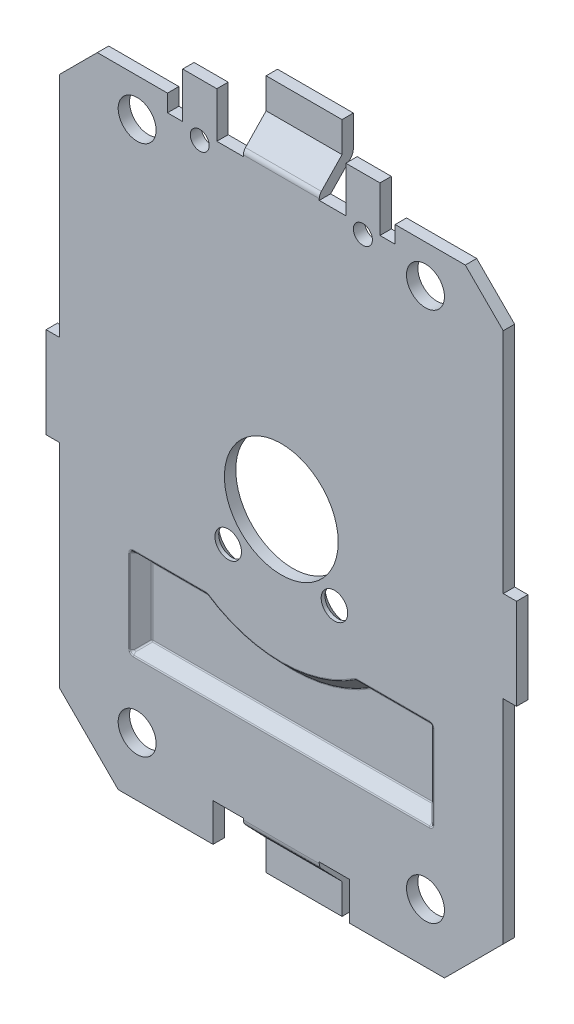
SolidWorks part; units mm, degrees
ref_plane "Plan de face" through (0, 0, 0) normal (0, 0, 1) x (1, 0, 0)
ref_plane "Plan de dessus" through (0, 0, 0) normal (0, 1, 0) x (1, 0, 0)
ref_plane "Plan de droite" through (0, 0, 0) normal (1, 0, 0) x (0, 0, -1)
sketch "Esquisse1" plane through (0, 0, 0) normal (0, 0, 1) x (1, 0, 0)
  line L8 (-31, 37.5) -> (-31, 7)
  line L9 (-31, 7) -> (-29.2494, 7)
  line L10 (-29.2494, 7) -> (-29.2494, 37.5)
  line L11 (-23, 43.7494) -> (23, 43.7494)
  line L12 (29.2494, 37.5) -> (29.2494, 7)
  line L13 (29.2494, 7) -> (31, 7)
  line L14 (31, 7) -> (31, 37.5)
  line L15 (23, 45.5) -> (-23, 45.5)
  line L16 (-31, 37.5) -> (-31, 7)
  line L17 (-31, 7) -> (-29.2494, 7)
  line L18 (-29.2494, 7) -> (-29.2494, 37.5)
  line L19 (-23, 43.7494) -> (23, 43.7494)
  line L20 (29.2494, 37.5) -> (29.2494, 7)
  line L21 (29.2494, 7) -> (31, 7)
  line L22 (31, 7) -> (31, 37.5)
  line L23 (23, 45.5) -> (-23, 45.5)
  line L24 (31, -37.5) -> (31, -7)
  line L25 (31, -7) -> (29.2494, -7)
  line L26 (29.2494, -7) -> (29.2494, -37.5)
  line L27 (23, -43.7494) -> (-23, -43.7494)
  line L28 (-29.2494, -37.5) -> (-29.2494, -7)
  line L29 (-29.2494, -7) -> (-31, -7)
  line L30 (-31, -7) -> (-31, -37.5)
  line L31 (-23, -45.5) -> (23, -45.5)
  line L32 (31, -37.5) -> (31, -7)
  line L33 (31, -7) -> (29.2494, -7)
  line L34 (29.2494, -7) -> (29.2494, -37.5)
  line L35 (23, -43.7494) -> (-23, -43.7494)
  line L36 (-29.2494, -37.5) -> (-29.2494, -7)
  line L37 (-29.2494, -7) -> (-31, -7)
  line L38 (-31, -7) -> (-31, -37.5)
  line L39 (-23, -45.5) -> (23, -45.5)
  arc A0 (-2.9394, 6.9) -> (2.9394, 6.9) centre (0, 0) ccw construction
  arc A1 (2.9394, 6.9) -> (-2.9394, 6.9) centre (0, 7.5) ccw construction
  circle A2 centre (-7, -7.5) radius 1.75 construction
  circle A3 centre (7, -7.5) radius 1.75 construction
  arc A4 (-23, 43.7494) -> (-29.2494, 37.5) centre (-23, 37.5) ccw
  arc A5 (29.2494, 37.5) -> (23, 43.7494) centre (23, 37.5) ccw
  arc A6 (31, 37.5) -> (23, 45.5) centre (23, 37.5) ccw
  arc A7 (-23, 45.5) -> (-31, 37.5) centre (-23, 37.5) ccw
  arc A8 (-23, 43.7494) -> (-29.2494, 37.5) centre (-23, 37.5) ccw
  arc A9 (29.2494, 37.5) -> (23, 43.7494) centre (23, 37.5) ccw
  arc A10 (31, 37.5) -> (23, 45.5) centre (23, 37.5) ccw
  arc A11 (-23, 45.5) -> (-31, 37.5) centre (-23, 37.5) ccw
  arc A12 (23, -43.7494) -> (29.2494, -37.5) centre (23, -37.5) ccw
  arc A13 (-29.2494, -37.5) -> (-23, -43.7494) centre (-23, -37.5) ccw
  arc A14 (-31, -37.5) -> (-23, -45.5) centre (-23, -37.5) ccw
  arc A15 (23, -45.5) -> (31, -37.5) centre (23, -37.5) ccw
  arc A16 (23, -43.7494) -> (29.2494, -37.5) centre (23, -37.5) ccw
  arc A17 (-29.2494, -37.5) -> (-23, -43.7494) centre (-23, -37.5) ccw
  arc A18 (-31, -37.5) -> (-23, -45.5) centre (-23, -37.5) ccw
  arc A19 (23, -45.5) -> (31, -37.5) centre (23, -37.5) ccw
  circle A20 centre (-19, -35) radius 2.5 construction
  circle A21 centre (19, -35) radius 2.5 construction
  circle A22 centre (19, 35) radius 2.5 construction
  circle A23 centre (-19, 35) radius 2.5 construction
  arc A24 (-2.9394, 6.9) -> (2.9394, 6.9) centre (0, 0) ccw
  arc A25 (2.9394, 6.9) -> (-2.9394, 6.9) centre (0, 7.5) ccw
  circle A26 centre (-7, -7.5) radius 1.75
  circle A27 centre (7, -7.5) radius 1.75
  circle A28 centre (-19, -35) radius 2.5
  circle A29 centre (19, -35) radius 2.5
  circle A30 centre (19, 35) radius 2.5
  circle A31 centre (-19, 35) radius 2.5
  dimension "D1" = 0
  dimension "D2" = 0
sketch "Esquisse2" plane through (0, 0, 0) normal (0, 0, 1) x (1, 0, 0)
  line L0 (-29.2494, 7) -> (-29.2494, 37.5) construction
  line L2 (29.2494, 37.5) -> (29.2494, 7) construction
  line L3 (29.2494, -7) -> (29.2494, -37.5) construction
  line L4 (-29.2494, -37.5) -> (-29.2494, -7) construction
  line L5 (23, -43.7494) -> (-23, -43.7494) construction
  line L6 (-31, 7) -> (-29.2494, 7) construction
  line L7 (-29.2494, -7) -> (-31, -7) construction
  line L8 (29.2494, 7) -> (31, 7) construction
  line L9 (31, -7) -> (29.2494, -7) construction
  line L10 (-29.2494, 7) -> (-29.2494, 35)
  line L11 (15, 40) -> (24.2494, 40)
  line L12 (29.2494, 35) -> (29.2494, 7)
  line L13 (29.2494, -7) -> (29.2494, -35)
  line L14 (-29.2494, -35) -> (-29.2494, -7)
  line L15 (20.5, -43.7494) -> (9, -43.7494)
  line L16 (-31, 7) -> (-29.2494, 7)
  line L17 (-29.2494, -7) -> (-31, -7)
  line L18 (29.2494, 7) -> (31, 7)
  line L19 (31, -7) -> (29.2494, -7)
  line L20 (-29.2494, 35) -> (-24.2494, 40)
  line L21 (24.2494, 40) -> (29.2494, 35)
  line L22 (-29.2494, -35) -> (-20.5, -43.7494)
  line L23 (20.5, -43.7494) -> (29.2494, -35)
  line L24 (-19, 43.4981) -> (-19, 35) construction
  line L25 (19, 35) -> (29.2494, 35) construction
  line L26 (-31, 7) -> (-31, -7)
  line L27 (31, 7) -> (31, -7)
  line L28 (0, 0) -> (0, -37.7494) construction
  line L29 (0, 0) -> (0, 38) construction
  line L30 (-9, -43.7494) -> (-9, -37.7494)
  line L31 (-9, -37.7494) -> (9, -37.7494)
  line L32 (9, -43.7494) -> (9, -37.7494)
  line L33 (-9, -43.7494) -> (-20.5, -43.7494)
  line L34 (-24.2494, 40) -> (-15, 40)
  line L35 (-15, 40) -> (-15, 37.7494)
  line L36 (-15, 37.7494) -> (-13, 37.7494)
  line L37 (15, 40) -> (15, 37.7494)
  line L38 (-19, -35) -> (-29.2494, -35) construction
  line L39 (19, -35) -> (29.2494, -35) construction
  line L40 (-19, 35) -> (-29.2494, 35) construction
  line L41 (-23, 43.7494) -> (23, 43.7494) construction
  line L42 (13, 37.7494) -> (15, 37.7494)
  line L43 (-13, 37.7494) -> (-13, 43.7494)
  line L44 (-13, 43.7494) -> (-8.5, 43.7494)
  line L45 (-8.5, 37.7494) -> (-8.5, 43.7494)
  line L46 (-8.5, 37.7494) -> (8.5, 37.7494)
  line L47 (-10.75, 43.7494) -> (-10.75, 36.7494) construction
  line L48 (13, 37.7494) -> (13, 43.7494)
  line L49 (13, 43.7494) -> (8.5, 43.7494)
  line L50 (8.5, 37.7494) -> (8.5, 43.7494)
  line L51 (10.75, 43.7494) -> (10.75, 36.7494) construction
  line L52 (-10.75, 36.7494) -> (10.75, 36.7494) construction
  arc A0 (-2.9394, 6.9) -> (2.9394, 6.9) centre (0, 0) ccw construction
  circle A2 centre (-7, -7.5) radius 1.75 construction
  circle A3 centre (7, -7.5) radius 1.75 construction
  circle A4 centre (-19, 35) radius 2.5 construction
  circle A5 centre (19, 35) radius 2.5 construction
  circle A6 centre (-19, -35) radius 2.5 construction
  circle A7 centre (19, -35) radius 2.5 construction
  circle A8 centre (0, 0) radius 7.5
  circle A9 centre (-10.75, 36.7494) radius 1.25
  circle A10 centre (-7, -7.5) radius 1.75
  circle A11 centre (7, -7.5) radius 1.75
  circle A12 centre (-19, 35) radius 2.5
  circle A13 centre (19, 35) radius 2.5
  circle A14 centre (-19, -35) radius 2.5
  circle A15 centre (19, -35) radius 2.5
  circle A16 centre (10.75, 36.7494) radius 1.25
  dimension "D10" = 2.5
  dimension "D1" = 45
  dimension "D2" = 18
  dimension "D3" = 6
  dimension "D4" = 30
  dimension "D5" = 6
  dimension "D6" = 5
  dimension "D7" = 17
  dimension "D8" = 4.5
  dimension "D9" = 7
extrude "Boss.-Extru.1" add sketch "Esquisse2" against normal up to surface (1.5 mm away)
sketch "Esquisse3" plane through (0, 0, 0) normal (-1, 0, 0) x (0, 0, 1)
  line L0 (-1.5, -37.7494) -> (0, -37.7494)
  line L1 (-4.5, 43.4766) -> (-4.5, 45.4766)
  line L2 (-4.0818, -40.4376) -> (-1.5, -37.7494)
  line L3 (0, 0) -> (21.3124, 0) construction
  line L4 (-4.5, 43.4766) -> (-4.5, 41.4766)
  line L5 (-4.0818, 40.4376) -> (-1.5, 37.7494)
  line L6 (-4.5, 45.4766) -> (-3, 45.4766)
  line L7 (-3, 45.4766) -> (-3, 41.4766)
  line L8 (-3, 41.4766) -> (-0.2788, 38.6433)
  line L9 (0, 37.9506) -> (0, 37.7494)
  line L10 (-1.5, 37.7494) -> (-0.4182, 38.7884) construction
  line L11 (-1.5, 43.7494) -> (0, 43.7494) construction
  line L12 (-4.5, 43.4766) -> (-3, 43.4766) construction
  line L13 (0, 43.7494) -> (0, 37.7494) construction
  line L14 (-1.5, 37.7494) -> (0, 37.7494)
  line L15 (-4.5, -43.4766) -> (-4.5, -45.4766)
  line L16 (-4.5, -43.4766) -> (-4.5, -41.4766)
  line L17 (-4.5, -45.4766) -> (-3, -45.4766)
  line L18 (0, -37.9506) -> (0, -37.7494)
  line L19 (-0.2788, -38.6433) -> (-3, -41.4766)
  line L20 (-3, -41.4766) -> (-3, -45.4766)
  arc A0 (-0.2788, 38.6433) -> (0, 37.9506) centre (-1, 37.9506) cw
  arc A1 (-4.5, 41.4766) -> (-4.0818, 40.4376) centre (-3, 41.4766) ccw
  arc A2 (-4.5, -41.4766) -> (-4.0818, -40.4376) centre (-3, -41.4766) cw
  arc A3 (0.2788, 38.6433) -> (0, 37.9506) centre (1, 37.9506) ccw
  arc A4 (-0.2788, -38.6433) -> (0, -37.9506) centre (-1, -37.9506) ccw
  dimension "D1" = 1
  dimension "D2" = 1.5
  dimension "D3" = 3
  dimension "D4" = 7.7272
  dimension "D5" = 4
extrude "Boss.-Extru.2" add sketch "Esquisse3" along normal mid plane 10 contours L19 A4 L18 L0 L2 A2 L16 L15 L17 L20 | L4 A1 L5 L14 L9 A0 L8 L7 L6 L1
chamfer "Chanfrein1" distance 1 angle 45 2 edges at (-7, -5.75, -1.5) (7, -5.75, -1.5)
sketch "Esquisse4" plane through (0, 0, -1.5) normal (0, 0, -1) x (-1, 0, 0)
  line L0 (19.5, -13) -> (9.3274, -13)
  line L1 (19.5, -28) -> (-19.5, -28)
  line L2 (21.5, -26) -> (21.5, -15)
  line L3 (-21.5, -26) -> (-21.5, -15)
  line L4 (0, 0) -> (0, -28) construction
  line L5 (-9.3274, -13) -> (-19.5, -13)
  arc A0 (-9.3274, -13) -> (9.3274, -13) centre (0, 0) ccw
  arc A1 (-19.5, -28) -> (-21.5, -26) centre (-19.5, -26) cw
  arc A2 (-19.5, -13) -> (-21.5, -15) centre (-19.5, -15) ccw
  arc A3 (19.5, -13) -> (21.5, -15) centre (19.5, -15) cw
  arc A4 (19.5, -28) -> (21.5, -26) centre (19.5, -26) ccw
  point P15 (21.5, -13)
  point P18 (21.5, -28)
  dimension "D1" = 32
  dimension "D4" = 2
  dimension "D2" = 13
  dimension "D3" = 15
  dimension "D5" = 43
extrude "Boss.-Extru.3" add sketch "Esquisse4" along normal blind 1.5
chamfer "Chanfrein2" distance 1.5 angle 45 10 edges at (21.5, -20.5, -3) (20.9142, -13.5858, -3) (14.4137, -13, -3) (0, -16, -3) (-14.4137, -13, -3) (-20.9142, -13.5858, -3) (-21.5, -20.5, -3) (-20.9142, -27.4142, -3) (0, -28, -3) (20.9142, -27.4142, -3)
fillet "Congé1" radius 1 10 edges at (14.649, -14.5, -3) (0, -17.5, -3) (-14.649, -14.5, -3) (-19.8536, -14.6464, -3) (-20, -20.5, -3) (-19.8536, -26.3536, -3) (0, -26.5, -3) (19.8536, -26.3536, -3) (20, -20.5, -3) (19.8536, -14.6464, -3)
sketch "Esquisse5" plane through (0, 0, 0) normal (0, 0, 1) x (1, 0, 0)
  line L0 (-19.5, -13) -> (-9.3274, -13) construction
  line L1 (-21.5, -26) -> (-21.5, -15) construction
  line L2 (9.3274, -13) -> (19.5, -13) construction
  line L3 (21.5, -15) -> (21.5, -26) construction
  line L4 (19.5, -28) -> (-19.5, -28) construction
  line L5 (-19.5, -13) -> (-9.3274, -13) construction
  line L6 (-21.5, -26) -> (-21.5, -15) construction
  line L7 (9.3274, -13) -> (19.5, -13) construction
  line L8 (21.5, -15) -> (21.5, -26) construction
  line L9 (19.5, -28) -> (-19.5, -28) construction
  line L10 (19.5, -26.5) -> (-19.5, -26.5)
  line L11 (-20, -26) -> (-20, -15)
  line L12 (-19.5, -14.5) -> (-9.798, -14.5)
  line L13 (9.798, -14.5) -> (19.5, -14.5)
  line L14 (20, -15) -> (20, -26)
  arc A0 (-19.5, -13) -> (-21.5, -15) centre (-19.5, -15) ccw construction
  arc A1 (-21.5, -26) -> (-19.5, -28) centre (-19.5, -26) ccw construction
  arc A2 (-9.3274, -13) -> (9.3274, -13) centre (0, 0) ccw construction
  arc A3 (21.5, -15) -> (19.5, -13) centre (19.5, -15) ccw construction
  arc A4 (19.5, -28) -> (21.5, -26) centre (19.5, -26) ccw construction
  arc A5 (-19.5, -13) -> (-21.5, -15) centre (-19.5, -15) ccw construction
  arc A6 (-21.5, -26) -> (-19.5, -28) centre (-19.5, -26) ccw construction
  arc A7 (-9.3274, -13) -> (9.3274, -13) centre (0, 0) ccw construction
  arc A8 (21.5, -15) -> (19.5, -13) centre (19.5, -15) ccw construction
  arc A9 (19.5, -28) -> (21.5, -26) centre (19.5, -26) ccw construction
  arc A10 (-20, -26) -> (-19.5, -26.5) centre (-19.5, -26) ccw
  arc A11 (-19.5, -14.5) -> (-20, -15) centre (-19.5, -15) ccw
  arc A12 (-9.798, -14.5) -> (9.798, -14.5) centre (0, 0) ccw
  arc A13 (20, -15) -> (19.5, -14.5) centre (19.5, -15) ccw
  arc A14 (19.5, -26.5) -> (20, -26) centre (19.5, -26) ccw
  dimension "D1" = 1.5
extrude "Enlèv. mat.-Extru.1" cut sketch "Esquisse5" against normal blind 1.5 draft 45
fillet "Congé2" radius 0.25 20 edges at (-14.649, -14.5, 0) (-19.8536, -14.6464, 0) (-20, -20.5, 0) (-19.8536, -26.3536, 0) (14.649, -14.5, 0) (19.8536, -14.6464, 0) (20, -20.5, 0) (19.8536, -26.3536, 0) (0, -17.5, 0) (-19, -25.5, -1) (19, -25.5, -1) (0, -26.5, 0) (0, -25, -1.5) (-18.5, -20.5, -1.5) (-14.3735, -16, -1.5) (0, -19, -1.5) (14.3735, -16, -1.5) (18.5, -20.5, -1.5)
sketch "Esquisse6" plane through (0, 0, -1.5) normal (0, 0, -1) x (-1, 0, 0)
  line L0 (-31, -7) -> (-31, 7) construction
  line L1 (31, 7) -> (29.2494, 7)
  line L2 (31, 7) -> (31, 5)
  line L3 (31, 5) -> (29.2494, 5)
  line L4 (29.2494, 7) -> (29.2494, 5)
  line L5 (-29.2494, 7) -> (-31, 7)
  line L6 (-29.2494, 7) -> (-29.2494, 5)
  line L7 (-29.2494, 5) -> (-31, 5)
  line L8 (-31, 7) -> (-31, 5)
  line L9 (29.2494, 35) -> (29.2494, 7) construction
  line L10 (29.2494, -35) -> (20.5, -43.7494) construction
  line L11 (21.5, -42.7494) -> (-21.5, -42.7494)
  line L12 (21.5, -42.7494) -> (21.5, -43.7494)
  line L13 (21.5, -43.7494) -> (-21.5, -43.7494)
  line L14 (-21.5, -42.7494) -> (-21.5, -43.7494)
  line L15 (-20.5, -43.7494) -> (-29.2494, -35) construction
  line L16 (20.5, -43.7494) -> (9, -43.7494) construction
  dimension "D1" = 2
  dimension "D2" = 1
extrude "Enlèv. mat.-Extru.2" cut sketch "Esquisse6" against normal up to next
